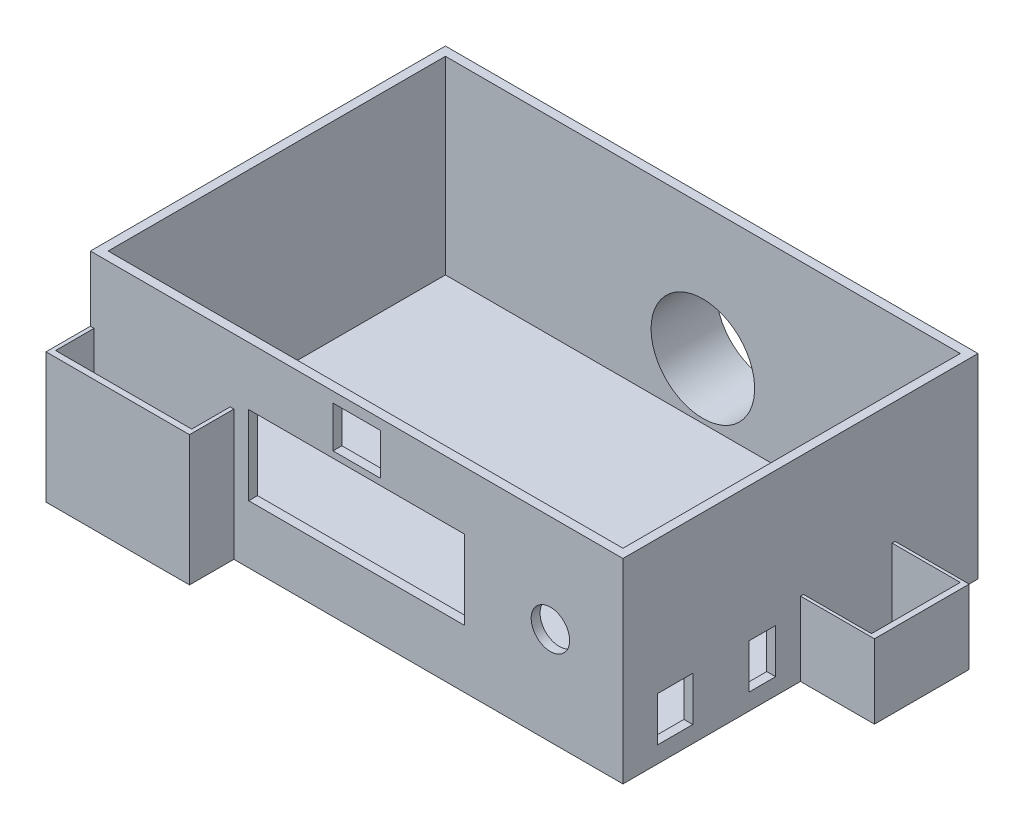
SolidWorks part; units mm, degrees
ref_plane "Front Plane" through (0, 0, 0) normal (0, 0, 1) x (1, 0, 0)
ref_plane "Top Plane" through (0, 0, 0) normal (0, 1, 0) x (1, 0, 0)
ref_plane "Right Plane" through (0, 0, 0) normal (1, 0, 0) x (0, 0, -1)
sketch "Sketch1" plane through (0, 0, 0) normal (0, 1, 0) x (1, 0, 0)
  line L1 (-90, 60) -> (90, 60)
  line L2 (-90, 60) -> (-90, -60)
  line L3 (-90, -60) -> (90, -60)
  line L4 (90, 60) -> (90, -60)
  line L5 (-90, 60) -> (90, -60) construction
  line L6 (-90, -60) -> (90, 60) construction
  point P0 (0, 0)
  dimension "D1" = 180
  dimension "D2" = 120
extrude "Boss-Extrude1" add sketch "Sketch1" along normal blind 66
sketch "Sketch2" plane through (0, 66, 0) normal (0, 1, 0) x (1, 0, 0)
  line L0 (90, -60) -> (90, 60) construction
  line L1 (-87, 57) -> (87, 57)
  line L2 (-87, 57) -> (-87, -57)
  line L3 (-87, -57) -> (87, -57)
  line L4 (87, 57) -> (87, -57)
  line L5 (-87, 57) -> (87, -57) construction
  line L6 (-87, -57) -> (87, 57) construction
  line L7 (-90, -60) -> (90, -60) construction
  point P1 (0, 0)
  dimension "D1" = 3
  dimension "D2" = 3
extrude "Cut-Extrude1" cut sketch "Sketch2" against normal blind 64
sketch "Sketch3" plane through (0, 0, 60) normal (0, 0, 1) x (1, 0, 0)
  line L0 (0, 0) -> (0, 66) construction
  line L1 (-90, 66) -> (90, 66) construction
  line L2 (-90, 33) -> (90, 33) construction
  line L3 (90, 66) -> (90, 0) construction
  line L5 (-36.5, 46.35) -> (36.5, 46.35)
  line L6 (-36.5, 46.35) -> (-36.5, 19.65)
  line L7 (-36.5, 19.65) -> (36.5, 19.65)
  line L8 (36.5, 46.35) -> (36.5, 19.65)
  line L9 (-36.5, 46.35) -> (36.5, 19.65) construction
  line L10 (-36.5, 19.65) -> (36.5, 46.35) construction
  circle A0 centre (65.4779, 33) radius 6.5
  point P5 (0, 33)
  point P10 (0, 33)
  dimension "D3" = 13
  dimension "D1" = 73
  dimension "D2" = 26.7
extrude "Cut-Extrude2" cut sketch "Sketch3" against normal up to next
sketch "Sketch4" plane through (90, 0, 0) normal (1, 0, 0) x (0, 0, -1)
  line L0 (-60, 0) -> (60, 0) construction
  line L1 (-48.4, 20.6) -> (-36.4, 20.6)
  line L2 (-48.4, 20.6) -> (-48.4, 5.6)
  line L3 (-48.4, 5.6) -> (-36.4, 5.6)
  line L4 (-36.4, 20.6) -> (-36.4, 5.6)
  line L5 (-48.4, 20.6) -> (-36.4, 5.6) construction
  line L6 (-48.4, 5.6) -> (-36.4, 20.6) construction
  line L7 (-17.4, 20.6) -> (-8.4, 20.6)
  line L8 (-17.4, 20.6) -> (-17.4, 5.6)
  line L9 (-17.4, 5.6) -> (-8.4, 5.6)
  line L10 (-8.4, 20.6) -> (-8.4, 5.6)
  line L11 (-17.4, 20.6) -> (-8.4, 5.6) construction
  line L12 (-17.4, 5.6) -> (-8.4, 20.6) construction
  line L13 (-60, 66) -> (-60, 0) construction
  point P0 (-42.4, 13.1)
  point P5 (-12.9, 13.1)
  dimension "D1" = 5.6
  dimension "D2" = 5.6
  dimension "D3" = 11.6
  dimension "D4" = 12
  dimension "D5" = 9
  dimension "D6" = 15
  dimension "D7" = 19
  dimension "D8" = 15
extrude "Cut-Extrude3" cut sketch "Sketch4" against normal up to next
sketch "Sketch5" plane through (90, 0, 0) normal (1, 0, 0) x (0, 0, -1)
  line L0 (-60, 0) -> (60, 0) construction
  line L1 (0, 25) -> (32, 25)
  line L2 (0, 25) -> (0, 0)
  line L3 (0, 0) -> (32, 0)
  line L4 (32, 25) -> (32, 0)
  line L5 (0, 25) -> (32, 0) construction
  line L6 (0, 0) -> (32, 25) construction
  line L7 (-60, 66) -> (-60, 0) construction
  point P0 (16, 12.5)
  dimension "D1" = 32
  dimension "D2" = 25
  dimension "D3" = 12.5
  dimension "D4" = 60
extrude "Boss-Extrude2" add sketch "Sketch5" along normal blind 25
sketch "Sketch6" plane through (0, 25, 0) normal (0, 1, 0) x (1, 0, 0)
  line L0 (90, 1) -> (113, 1)
  line L1 (90, -60) -> (90, 60) construction
  line L2 (113, 1) -> (113, 31)
  line L3 (113, 31) -> (90, 31)
  line L4 (90, 31) -> (90, 1)
  line L5 (115, 0) -> (90, 0) construction
  line L6 (115, 32) -> (90, 32) construction
  dimension "D1" = 1
  dimension "D2" = 1
  dimension "D3" = 23
extrude "Cut-Extrude4" cut sketch "Sketch6" against normal blind 23
sketch "Sketch8" plane through (0, 0, 60) normal (0, 0, 1) x (1, 0, 0)
  line L0 (-90, 0) -> (-90, 44)
  line L1 (-90, 0) -> (90, 0) construction
  line L2 (-90, 44) -> (-41.5, 44)
  line L3 (-41.5, 44) -> (-41.5, 0)
  line L4 (-41.5, 0) -> (-90, 0)
  line L5 (-90, 66) -> (-90, 0) construction
  dimension "D1" = 48.5
  dimension "D2" = 44
  dimension "D3" = 0
extrude "Boss-Extrude3" add sketch "Sketch8" along normal blind 15
sketch "Sketch9" plane through (0, 44, 0) normal (0, 1, 0) x (1, 0, 0)
  line L0 (-88.75, -60) -> (-88.75, -73)
  line L1 (-41.5, -60) -> (-90, -60) construction
  line L2 (-88.75, -73) -> (-42.75, -73)
  line L3 (-42.75, -73) -> (-42.75, -60)
  line L4 (-42.75, -60) -> (-88.75, -60)
  line L5 (-90, -75) -> (-90, -60) construction
  dimension "D1" = 46
  dimension "D2" = 1.25
  dimension "D3" = 13
extrude "Cut-Extrude5" cut sketch "Sketch9" against normal blind 42
sketch "Sketch11" plane through (0, 0, 60) normal (0, 0, 1) x (1, 0, 0)
  line L0 (-90, 66) -> (90, 66) construction
  line L1 (-8, 62.5) -> (8, 62.5)
  line L2 (-8, 62.5) -> (-8, 48.5)
  line L3 (-8, 48.5) -> (8, 48.5)
  line L4 (8, 62.5) -> (8, 48.5)
  line L5 (-8, 62.5) -> (8, 48.5) construction
  line L6 (-8, 48.5) -> (8, 62.5) construction
  line L7 (-90, 66) -> (-90, 44) construction
  point P0 (0, 55.5)
  dimension "D1" = 16
  dimension "D2" = 14
  dimension "D3" = 3.5
  dimension "D4" = 82
extrude "Cut-Extrude6" cut sketch "Sketch11" against normal up to next
sketch "Sketch13" plane through (0, 0, -60) normal (0, 0, -1) x (-1, 0, 0)
  line L0 (0, 0) -> (0, 66) construction
  line L1 (-90, 66) -> (90, 66) construction
  line L2 (-90, 0) -> (90, 0) construction
  circle A0 centre (0, 21) radius 17.5
  point P10 (0, 33)
  dimension "D1" = 35
  dimension "D2" = 21
extrude "Cut-Extrude7" cut sketch "Sketch13" against normal blind 3
sketch "Sketch14" plane through (0, 0, -60) normal (0, 0, -1) x (-1, 0, 0)
  line L0 (0, -24) -> (0, 66) construction
  line L3 (-90, 0) -> (90, 0) construction
  line L4 (-90, 66) -> (-90, 0) construction
  circle A0 centre (0, 21) radius 17.5
  circle A1 centre (0, 21) radius 20.5
  dimension "D1" = 3
  dimension "D2" = 35
  dimension "D4" = 90
  dimension "D3" = 21
extrude "Boss-Extrude5" add sketch "Sketch14" along normal blind 19
